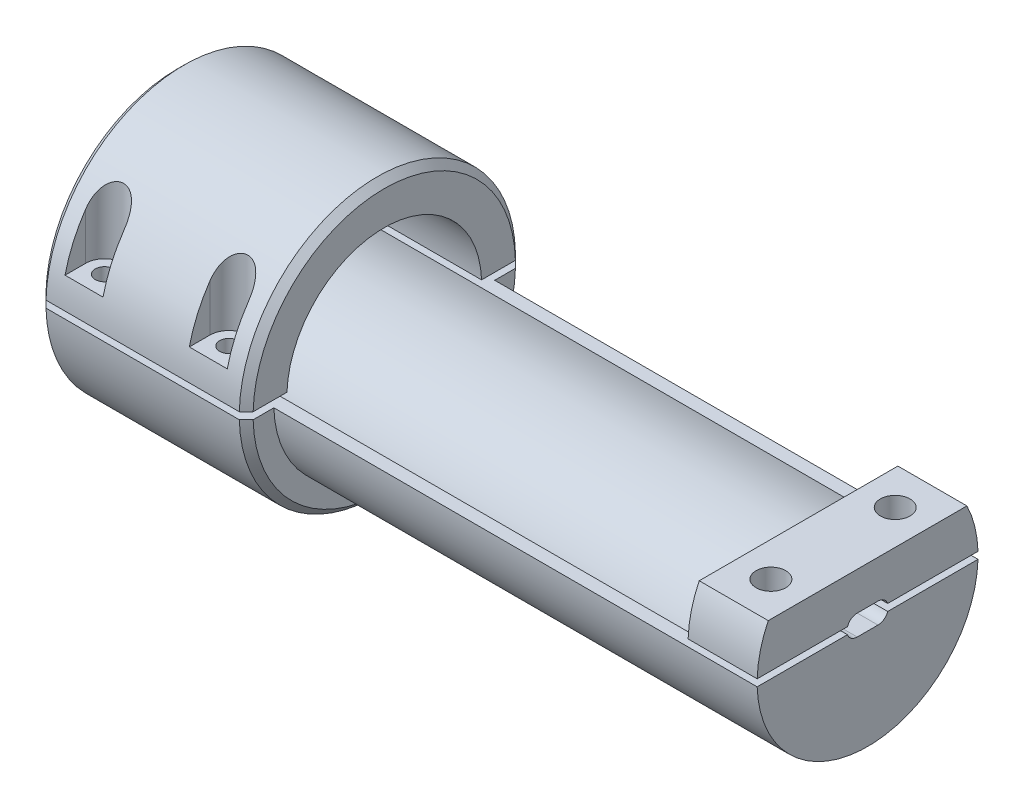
SolidWorks part; units mm, degrees
ref_plane "Vorne" through (0, 0, 0) normal (0, 0, 1) x (1, 0, 0)
ref_plane "Oben" through (0, 0, 0) normal (0, 1, 0) x (1, 0, 0)
ref_plane "Rechts" through (0, 0, 0) normal (1, 0, 0) x (0, 0, -1)
sketch "Skizze1" plane through (0, 0, 0) normal (0, 0, 1) x (1, 0, 0)
  line L0 (0, 0) -> (-93.2147, 0) construction
  line L1 (0, 0) -> (0, 16)
  line L2 (0, 16) -> (-70, 16)
  line L3 (-70, 16) -> (-70, 20)
  line L4 (-70, 20) -> (-100, 20)
  line L5 (-100, 20) -> (-100, 0)
  line L6 (0, 0) -> (-100, 0)
  dimension "D1" = 30
  dimension "D2" = 100
  dimension "D3" = 32
  dimension "D4" = 40
revolve "Rotation1" add sketch "Skizze1" angle 360 about L0
sketch "Skizze2" plane through (0, 0, 0) normal (0, 0, 1) x (1, 0, 0)
  line L0 (0, 7) -> (-10, 7)
  line L1 (0, -16) -> (0, 16) construction
  line L2 (-10, 7) -> (-10, 0)
  line L3 (-10, 0) -> (-70, 0)
  line L4 (-70, -20) -> (-70, 20) construction
  line L5 (-70, 0) -> (-70, 16)
  line L6 (-70, 16) -> (0, 16)
  line L7 (0, 16) -> (-70, 16) construction
  line L8 (0, 16) -> (0, 7)
  dimension "D1" = 7
  dimension "D2" = 10
extrude "Linear austragen1" cut sketch "Skizze2" against normal mid plane 46
sketch "Skizze4" plane through (-100, 0, 0) normal (-1, 0, 0) x (0, 0, 1)
  circle A0 centre (0, 0) radius 14.1
  dimension "D1" = 28.2
extrude "Linear austragen2" cut sketch "Skizze4" against normal blind 90
ref_plane "Ebene1" through (0, 20, 0) normal (0, 1, 0) x (-1, 0, 0)
sketch "Skizze15" plane through (0, 20, 0) normal (0, 1, 0) x (-1, 0, 0)
  line L0 (91.25, 16.5) -> (91.25, 20)
  line L1 (91.25, 20) -> (96.75, 20)
  line L2 (96.75, 20) -> (96.75, 16.5)
  line L3 (100, 0) -> (70, 0) construction
  line L4 (0, -14.3875) -> (0, 14.3875) construction
  line L5 (85, 17.4501) -> (85, -10.1304) construction
  line L6 (78.75, -20) -> (73.25, -20)
  line L7 (0, 0) -> (18.7861, 0) construction
  line L8 (10, 0) -> (100, 0) construction
  line L9 (10, 0) -> (0, 0) construction
  line L10 (96.75, -20) -> (96.75, -16.5)
  line L11 (91.25, -20) -> (96.75, -20)
  line L12 (91.25, -16.5) -> (91.25, -20)
  line L13 (73.25, -20) -> (73.25, -16.5)
  line L14 (78.75, -16.5) -> (78.75, -20)
  line L15 (73.25, 20) -> (73.25, 16.5)
  line L16 (78.75, 20) -> (73.25, 20)
  line L17 (78.75, 16.5) -> (78.75, 20)
  arc A0 (91.25, 16.5) -> (96.75, 16.5) centre (94, 16.5) ccw
  arc A1 (91.25, -16.5) -> (96.75, -16.5) centre (94, -16.5) cw
  arc A2 (78.75, -16.5) -> (73.25, -16.5) centre (76, -16.5) ccw
  arc A3 (78.75, 16.5) -> (73.25, 16.5) centre (76, 16.5) cw
  dimension "D1" = 5.5
  dimension "D2" = 16.5
  dimension "D3" = 94
  dimension "D4" = 3.5
  dimension "D5" = 85
extrude "Linear austragen5" cut sketch "Skizze15" against normal blind 15.5
hole_wizard "Ø2.7 (2.7) Durchmesser Bohrung1" positions "Skizze17" profile "Skizze16" hole size "Ø2.7" standard "ISO"
sketch "Skizze17" plane through (0, 4.5, 0) normal (0, 1, 0) x (-1, 0, 0)
  point P0 (76, -16.5)
  point P1 (94, -16.5)
  point P4 (94, 16.5)
  point P7 (76, 16.5)
sketch "Skizze16" plane through (-76, 4.5, -16.5) normal (1, 0, 0) x (0, 0, 1)
  line L0 (0, 0) -> (0, 4)
  line L1 (0, 4) -> (1.35, 4)
  line L2 (1.35, 4) -> (1.35, 0)
  line L5 (1.35, 0) -> (0, 0)
  line L10 (0, 4) -> (-1.35, 4) construction
  line L11 (0, -6.35) -> (0, 107.95) construction
  dimension "Bohrerdurchmesser" = 2.7
  dimension "Bohrungstiefe" = 4
  dimension "Spitzenwinkel" = 180
hole_wizard "Ø4.3 (4.3) Durchmesser Bohrung1" positions "Skizze10" profile "Skizze9" hole size "Ø4.3" standard "ISO"
sketch "Skizze10" plane through (0, 7, 0) normal (0, 1, 0) x (-1, 0, 0)
  point P0 (5, 9)
  point P1 (5, -9)
  dimension "D1" = 5
  dimension "D2" = 9
  dimension "D3" = 9
sketch "Skizze9" plane through (-5, 7, 9) normal (1, 0, 0) x (0, 0, 1)
  line L0 (0, 0) -> (0, 7)
  line L1 (0, 7) -> (2.15, 7)
  line L2 (2.15, 7) -> (2.15, 0)
  line L5 (2.15, 0) -> (0, 0)
  line L10 (0, 7) -> (-2.15, 7) construction
  line L11 (0, -6.35) -> (0, 107.95) construction
  dimension "Bohrerdurchmesser" = 4.3
  dimension "Bohrungstiefe" = 7
  dimension "Spitzenwinkel" = 180
chamfer "Fase1" distance 1 angle 45 2 edges at (-100, 0, -20) (-70, 0, -20)
sketch "Skizze13" plane through (0, 0, 0) normal (0, 0, 1) x (1, 0, 0)
  line L0 (-100, 20) -> (-100, -20) construction
  line L1 (-100, 0.5) -> (0, 0.5)
  line L2 (-100, 0.5) -> (-100, -0.5)
  line L3 (-100, -0.5) -> (0, -0.5)
  line L4 (0, 0.5) -> (0, -0.5)
  line L5 (0, -16) -> (0, 7) construction
  dimension "D1" = 0.5
  dimension "D2" = 1
extrude "Linear austragen3" cut sketch "Skizze13" against normal mid plane 70
sketch "Skizze14" plane through (0, 0, 0) normal (1, 0, 0) x (0, 0, -1)
  line L0 (-1.5, 0) -> (1.5, 0) construction
  line L1 (-1.5, -1.5) -> (1.5, -1.5)
  line L2 (-1.5, 1.5) -> (1.5, 1.5)
  arc A0 (-1.5, -1.5) -> (-1.5, 1.5) centre (-1.5, 0) cw
  arc A1 (1.5, -1.5) -> (1.5, 1.5) centre (1.5, 0) ccw
  dimension "D3" = 3
  dimension "D4" = 1.5
  dimension "D1" = 1.5
  dimension "D2" = 1.5
extrude "Linear austragen4" cut sketch "Skizze14" against normal through all
hole_wizard "M2.5 Gewindebohrung1" positions "Skizze8" profile "Skizze7" tap size "M2.5" standard "ISO"
sketch "Skizze8" plane through (-12.6702, -0.5, -17.2716) normal (0, 1, 0) x (-1, 0, 0)
  point P1 (81.3298, 33.7716)
  point P4 (81.3298, 0.7716)
  point P14 (63.3298, 33.7716)
  point P17 (63.3298, 0.7716)
sketch "Skizze7" plane through (-94, -0.5, 16.5) normal (1, 0, 0) x (0, 0, 1)
  line L0 (0, 0) -> (0, 6.6159)
  line L1 (0, 6.6159) -> (1.025, 6)
  line L2 (1.025, 6) -> (1.025, 0)
  line L5 (1.025, 0) -> (0, 0)
  line L10 (0, 6.6159) -> (-1.025, 6) construction
  line L11 (0, -6.35) -> (0, 107.95) construction
  dimension "Bohrerdurchmesser" = 2.05
  dimension "Bohrungstiefe" = 6
  dimension "Spitzenwinkel" = 118
hole_wizard "M4 Gewindebohrung1" positions "Skizze12" profile "Skizze11" tap size "M4" standard "ISO"
sketch "Skizze12" plane through (0.8907, -0.5, -10.1807) normal (0, 1, 0) x (-1, 0, 0)
  point P1 (5.8907, 1.1807)
  point P4 (5.8907, 19.1807)
sketch "Skizze11" plane through (-5, -0.5, -9) normal (1, 0, 0) x (0, 0, 1)
  line L0 (0, 0) -> (0, 9.4914)
  line L1 (0, 9.4914) -> (1.65, 8.5)
  line L2 (1.65, 8.5) -> (1.65, 0)
  line L5 (1.65, 0) -> (0, 0)
  line L10 (0, 9.4914) -> (-1.65, 8.5) construction
  line L11 (0, -6.35) -> (0, 107.95) construction
  dimension "Bohrerdurchmesser" = 3.3
  dimension "Bohrungstiefe" = 8.5
  dimension "Spitzenwinkel" = 118
